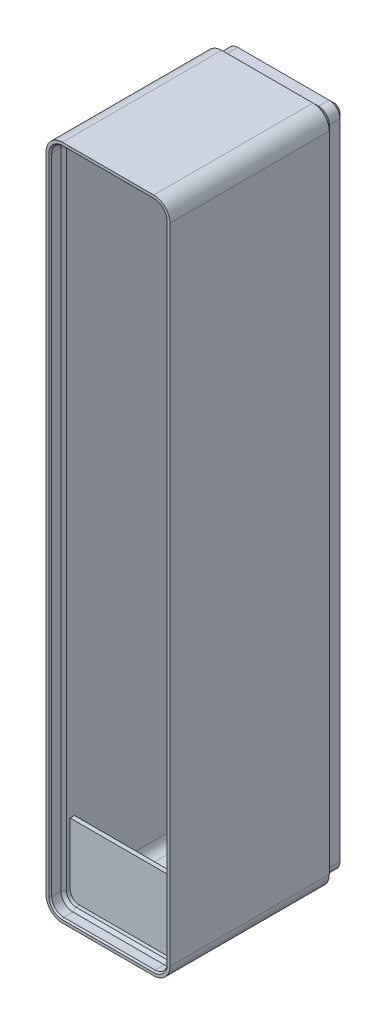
SolidWorks part; units mm, degrees
ref_plane "Front Plane" through (0, 0, 0) normal (0, 0, 1) x (1, 0, 0)
ref_plane "Top Plane" through (0, 0, 0) normal (0, 1, 0) x (1, 0, 0)
ref_plane "Right Plane" through (0, 0, 0) normal (1, 0, 0) x (0, 0, -1)
sketch "Sketch2" plane through (0, 0, 0) normal (0, 0, 1) x (1, 0, 0)
  line L1 (-6.45, 46.25) -> (6.45, 46.25)
  line L2 (-7.25, 45.45) -> (-7.25, -45.45)
  line L3 (-6.45, -46.25) -> (6.45, -46.25)
  line L4 (7.25, 45.45) -> (7.25, -45.45)
  line L5 (-7.25, 46.25) -> (7.25, -46.25) construction
  line L6 (-7.25, -46.25) -> (7.25, 46.25) construction
  arc A0 (6.45, -46.25) -> (7.25, -45.45) centre (6.45, -45.45) ccw
  arc A1 (-7.25, -45.45) -> (-6.45, -46.25) centre (-6.45, -45.45) ccw
  arc A2 (6.45, 46.25) -> (7.25, 45.45) centre (6.45, 45.45) cw
  arc A3 (-6.45, 46.25) -> (-7.25, 45.45) centre (-6.45, 45.45) ccw
  point P0 (0, 0)
  dimension "D3" = 0.8
  dimension "D1" = 14.5
  dimension "D2" = 92.5
extrude "Boss-Extrude1" add sketch "Sketch2" along normal blind 0.7 draft 45
sketch "Sketch3" plane through (0, 0, 0.7) normal (0, 0, 1) x (1, 0, 0)
  line L4 (7.95, -45.45) -> (7.95, 45.45)
  line L5 (6.45, 46.95) -> (-6.45, 46.95)
  line L6 (-7.95, 45.45) -> (-7.95, -45.45)
  line L7 (-6.45, -46.95) -> (6.45, -46.95)
  line L8 (7.95, -45.45) -> (7.95, 45.45)
  line L9 (6.45, 46.95) -> (-6.45, 46.95)
  line L10 (-7.95, 45.45) -> (-7.95, -45.45)
  line L11 (-6.45, -46.95) -> (6.45, -46.95)
  arc A4 (6.45, -46.95) -> (7.95, -45.45) centre (6.45, -45.45) ccw
  arc A5 (6.45, -46.95) -> (7.95, -45.45) centre (6.45, -45.45) ccw
  arc A6 (7.95, 45.45) -> (6.45, 46.95) centre (6.45, 45.45) ccw
  arc A7 (7.95, 45.45) -> (6.45, 46.95) centre (6.45, 45.45) ccw
  arc A8 (-6.45, 46.95) -> (-7.95, 45.45) centre (-6.45, 45.45) ccw
  arc A9 (-6.45, 46.95) -> (-7.95, 45.45) centre (-6.45, 45.45) ccw
  arc A10 (-7.95, -45.45) -> (-6.45, -46.95) centre (-6.45, -45.45) ccw
  arc A11 (-7.95, -45.45) -> (-6.45, -46.95) centre (-6.45, -45.45) ccw
  dimension "D1" = 0
extrude "Boss-Extrude2" add sketch "Sketch3" along normal blind 1.5
sketch "Sketch4" plane through (0, 0, 2.2) normal (0, 0, 1) x (1, 0, 0)
  line L4 (-6.45, -46.95) -> (6.45, -46.95)
  line L5 (7.95, -45.45) -> (7.95, 45.45)
  line L6 (6.45, 46.95) -> (-6.45, 46.95)
  line L7 (-7.95, 45.45) -> (-7.95, -45.45)
  line L8 (-6.45, -46.95) -> (6.45, -46.95)
  line L9 (7.95, -45.45) -> (7.95, 45.45)
  line L10 (6.45, 46.95) -> (-6.45, 46.95)
  line L11 (-7.95, 45.45) -> (-7.95, -45.45)
  arc A4 (7.95, 45.45) -> (6.45, 46.95) centre (6.45, 45.45) ccw
  arc A5 (7.95, 45.45) -> (6.45, 46.95) centre (6.45, 45.45) ccw
  arc A6 (-6.45, 46.95) -> (-7.95, 45.45) centre (-6.45, 45.45) ccw
  arc A7 (-6.45, 46.95) -> (-7.95, 45.45) centre (-6.45, 45.45) ccw
  arc A8 (-7.95, -45.45) -> (-6.45, -46.95) centre (-6.45, -45.45) ccw
  arc A9 (-7.95, -45.45) -> (-6.45, -46.95) centre (-6.45, -45.45) ccw
  arc A10 (6.45, -46.95) -> (7.95, -45.45) centre (6.45, -45.45) ccw
  arc A11 (6.45, -46.95) -> (7.95, -45.45) centre (6.45, -45.45) ccw
  dimension "D1" = 0
extrude "Boss-Extrude3" add sketch "Sketch4" along normal blind 0.8 draft 45
sketch "Sketch5" plane through (0, 0, 3) normal (0, 0, 1) x (1, 0, 0)
  line L4 (8.75, -45.45) -> (8.75, 45.45)
  line L5 (6.45, 47.75) -> (-6.45, 47.75)
  line L6 (-8.75, 45.45) -> (-8.75, -45.45)
  line L7 (-6.45, -47.75) -> (6.45, -47.75)
  line L8 (8.75, -45.45) -> (8.75, 45.45)
  line L9 (6.45, 47.75) -> (-6.45, 47.75)
  line L10 (-8.75, 45.45) -> (-8.75, -45.45)
  line L11 (-6.45, -47.75) -> (6.45, -47.75)
  arc A4 (6.45, -47.75) -> (8.75, -45.45) centre (6.45, -45.45) ccw
  arc A5 (8.75, 45.45) -> (6.45, 47.75) centre (6.45, 45.45) ccw
  arc A6 (-6.45, 47.75) -> (-8.75, 45.45) centre (-6.45, 45.45) ccw
  arc A7 (-8.75, -45.45) -> (-6.45, -47.75) centre (-6.45, -45.45) ccw
  arc A8 (6.45, -47.75) -> (8.75, -45.45) centre (6.45, -45.45) ccw
  arc A9 (8.75, 45.45) -> (6.45, 47.75) centre (6.45, 45.45) ccw
  arc A10 (-6.45, 47.75) -> (-8.75, 45.45) centre (-6.45, 45.45) ccw
  arc A11 (-8.75, -45.45) -> (-6.45, -47.75) centre (-6.45, -45.45) ccw
  dimension "D1" = 0
extrude "Boss-Extrude4" add sketch "Sketch5" along normal blind 22.5
shell "Shell1" thickness 1
sketch "Sketch6" plane through (0, 0, 25.5) normal (0, 0, 1) x (1, 0, 0)
  line L8 (-6.45, -47.35) -> (6.45, -47.35)
  line L9 (8.35, -45.45) -> (8.35, 45.45)
  line L10 (6.45, 47.35) -> (-6.45, 47.35)
  line L11 (-8.35, 45.45) -> (-8.35, -45.45)
  line L12 (-6.45, -47.35) -> (6.45, -47.35)
  line L13 (8.35, -45.45) -> (8.35, 45.45)
  line L14 (6.45, 47.35) -> (-6.45, 47.35)
  line L15 (-8.35, 45.45) -> (-8.35, -45.45)
  arc A8 (-8.35, -45.45) -> (-6.45, -47.35) centre (-6.45, -45.45) ccw
  arc A9 (6.45, -47.35) -> (8.35, -45.45) centre (6.45, -45.45) ccw
  arc A10 (8.35, 45.45) -> (6.45, 47.35) centre (6.45, 45.45) ccw
  arc A11 (-6.45, 47.35) -> (-8.35, 45.45) centre (-6.45, 45.45) ccw
  arc A12 (-8.35, -45.45) -> (-6.45, -47.35) centre (-6.45, -45.45) ccw
  arc A13 (6.45, -47.35) -> (8.35, -45.45) centre (6.45, -45.45) ccw
  arc A14 (8.35, 45.45) -> (6.45, 47.35) centre (6.45, 45.45) ccw
  arc A15 (-6.45, 47.35) -> (-8.35, 45.45) centre (-6.45, 45.45) ccw
  dimension "D1" = 0.4
extrude "Cut-Extrude1" cut sketch "Sketch6" against normal blind 0.2 draft 45
sketch "Sketch7" plane through (0, 0, 25.3) normal (0, 0, 1) x (1, 0, 0)
  line L4 (-6.45, -47.15) -> (6.45, -47.15)
  line L5 (8.15, -45.45) -> (8.15, 45.45)
  line L6 (6.45, 47.15) -> (-6.45, 47.15)
  line L7 (-8.15, 45.45) -> (-8.15, -45.45)
  line L8 (-6.45, -47.15) -> (6.45, -47.15)
  line L9 (8.15, -45.45) -> (8.15, 45.45)
  line L10 (6.45, 47.15) -> (-6.45, 47.15)
  line L11 (-8.15, 45.45) -> (-8.15, -45.45)
  arc A4 (-8.15, -45.45) -> (-6.45, -47.15) centre (-6.45, -45.45) ccw
  arc A5 (6.45, -47.15) -> (8.15, -45.45) centre (6.45, -45.45) ccw
  arc A6 (8.15, 45.45) -> (6.45, 47.15) centre (6.45, 45.45) ccw
  arc A7 (-6.45, 47.15) -> (-8.15, 45.45) centre (-6.45, 45.45) ccw
  arc A8 (-8.15, -45.45) -> (-6.45, -47.15) centre (-6.45, -45.45) ccw
  arc A9 (6.45, -47.15) -> (8.15, -45.45) centre (6.45, -45.45) ccw
  arc A10 (8.15, 45.45) -> (6.45, 47.15) centre (6.45, 45.45) ccw
  arc A11 (-6.45, 47.15) -> (-8.15, 45.45) centre (-6.45, 45.45) ccw
  dimension "D1" = 0
extrude "Cut-Extrude2" cut sketch "Sketch7" against normal blind 1.3
sketch "Sketch8" plane through (0, 0, 24) normal (0, 0, 1) x (1, 0, 0)
  line L0 (8.15, -45.45) -> (8.15, 45.45) construction
  line L1 (-6.45, -47.15) -> (6.45, -47.15) construction
  line L2 (-8.15, 45.45) -> (-8.15, -45.45) construction
  line L3 (6.45, 47.15) -> (-6.45, 47.15) construction
  line L4 (8.15, -45.45) -> (8.15, 45.45)
  line L5 (-6.45, -47.15) -> (6.45, -47.15)
  line L6 (-8.15, 45.45) -> (-8.15, -45.45)
  line L7 (6.45, 47.15) -> (-6.45, 47.15)
  arc A0 (6.45, -47.15) -> (8.15, -45.45) centre (6.45, -45.45) ccw construction
  arc A1 (-8.15, -45.45) -> (-6.45, -47.15) centre (-6.45, -45.45) ccw construction
  arc A2 (8.15, 45.45) -> (6.45, 47.15) centre (6.45, 45.45) ccw construction
  arc A3 (-6.45, 47.15) -> (-8.15, 45.45) centre (-6.45, 45.45) ccw construction
  arc A4 (6.45, -47.15) -> (8.15, -45.45) centre (6.45, -45.45) ccw
  arc A5 (-8.15, -45.45) -> (-6.45, -47.15) centre (-6.45, -45.45) ccw
  arc A6 (8.15, 45.45) -> (6.45, 47.15) centre (6.45, 45.45) ccw
  arc A7 (-6.45, 47.15) -> (-8.15, 45.45) centre (-6.45, 45.45) ccw
extrude "Cut-Extrude3" cut sketch "Sketch8" against normal blind 0.9 draft 45
sketch "Sketch9" plane through (0, 0, 0) normal (1, 0, 0) x (0, 0, -1)
  line L0 (-23.1, -46.75) -> (-23.1, -36.75)
  line L2 (-23.1, -46.75) -> (-12.5, -46.75)
  line L3 (-23.6, -46.75) -> (-3.4142, -46.75) construction
  line L5 (-23.1, -36.75) -> (-22.5, -36.75)
  line L6 (-22.5, -36.75) -> (-12.5, -46.75)
  line L9 (-25.5, -45.45) -> (-25.5, 45.45) construction
  dimension "D1" = 10
  dimension "D2" = 45
  dimension "D3" = 0.6
  dimension "D4" = 2.4
extrude "Boss-Extrude5" add sketch "Sketch9" along normal up to next and the other way up to next
sketch "Sketch10" [suppressed] plane through (0, 0, 23.1) normal (0, 0, 1) x (1, 0, 0)
  line L0 (-7.25, -43.75) -> (7.25, -43.75) construction
  line L1 (-7.25, -36.75) -> (-7.25, -45.45) construction
  line L2 (7.25, -45.45) -> (7.25, -36.75) construction
  line L3 (-6.45, -46.25) -> (6.45, -46.25) construction
  text T0 "1K5" font "Verdana" height 5
  point P5 (0, -43.75)
  dimension "D1" = 2.5
extrude "Marking" [suppressed] cut sketch "Sketch10" against normal blind 0.4
